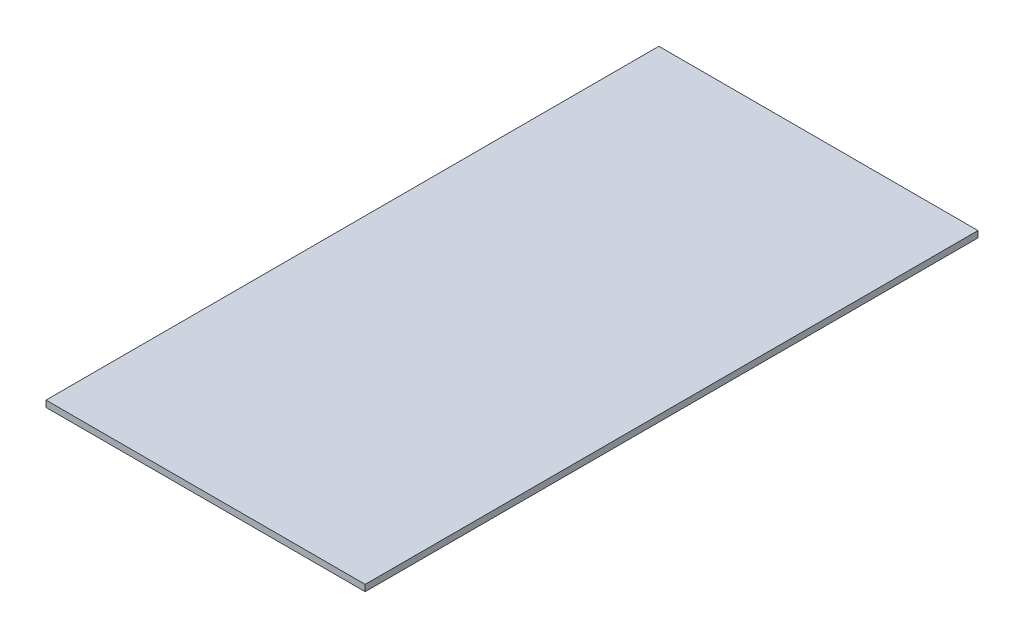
SolidWorks part; units mm, degrees
ref_plane "Front Plane" through (0, 0, 0) normal (0, 0, 1) x (1, 0, 0)
ref_plane "Top Plane" through (0, 0, 0) normal (0, 1, 0) x (1, 0, 0)
ref_plane "Right Plane" through (0, 0, 0) normal (1, 0, 0) x (0, 0, -1)
sketch "Sketch1" plane through (0, 0, 0) normal (0, 1, 0) x (1, 0, 0)
  line L1 (-317.5, -609.6) -> (317.5, -609.6)
  line L2 (-317.5, -609.6) -> (-317.5, 609.6)
  line L3 (-317.5, 609.6) -> (317.5, 609.6)
  line L4 (317.5, -609.6) -> (317.5, 609.6)
  line L5 (-317.5, -609.6) -> (317.5, 609.6) construction
  line L6 (-317.5, 609.6) -> (317.5, -609.6) construction
  point P0 (0, 0)
  dimension "D1" = 1219.2
  dimension "D2" = 635
extrude "Boss-Extrude1" add sketch "Sketch1" along normal mid plane 12.7
